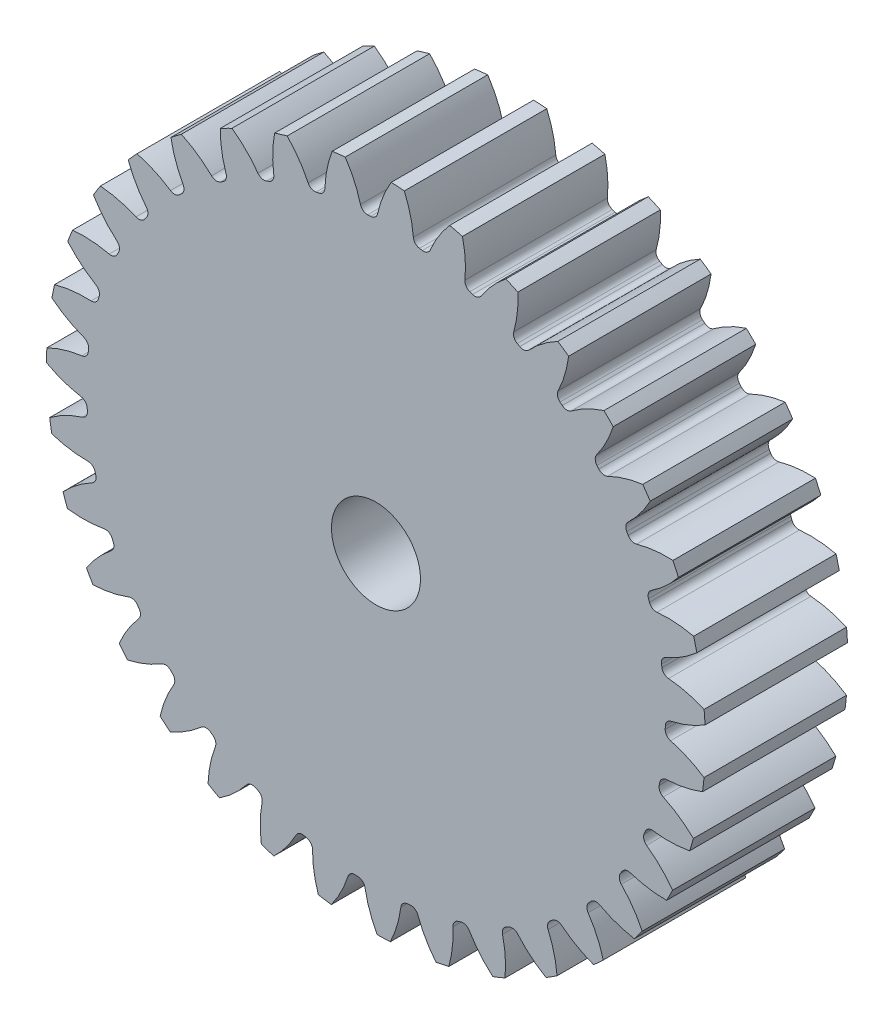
SolidWorks part; units mm, degrees
ref_plane "Front" through (0, 0, 0) normal (0, 0, 1) x (1, 0, 0)
ref_plane "Top" through (0, 0, 0) normal (0, 1, 0) x (1, 0, 0)
ref_plane "Right" through (0, 0, 0) normal (1, 0, 0) x (0, 0, -1)
sketch "Sketch3" plane through (0, 0, 0) normal (0, 0, 1) x (1, 0, 0)
  circle A0 centre (0, 0) radius 234.95
  dimension "od" = 469.9
extrude "gearBody" add sketch "Sketch3" along normal blind 101.6
sketch "Sketch2" plane through (0, 0, 0) normal (0, 0, 1) x (1, 0, 0)
  line L0 (0, 0) -> (192.9492, 79.9222) construction
  line L1 (234.2444, -21.5553) -> (0, 0) construction
  line L2 (0, 0) -> (36.3143, 0) construction
  line L3 (222.1891, 5.2033) -> (221.7657, -14.6639) construction
  line L5 (221.9774, -4.7303) -> (0, 0) construction
  line L7 (0, 0) -> (208.8467, 0) construction
  arc A0 (208.8428, 1.2757) -> (208.5989, -10.1712) centre (0, 0) ccw construction
  arc A1 (234.6738, 11.388) -> (233.9757, -21.3748) centre (0, 0) ccw construction
  arc A2 (222.1891, 5.2033) -> (221.7657, -14.6639) centre (0, 0) ccw construction
  arc A3 (206.3034, -5.437) -> (206.3477, -3.3565) centre (0, 0) ccw
  arc A4 (234.2444, -21.5553) -> (210.1329, -10.566) centre (189.3693, -88.0693) ccw
  arc A5 (234.2444, -21.5553) -> (234.95, 11.5569) centre (0, 0) ccw
  arc A6 (234.95, 11.5569) -> (210.3922, 1.6047) centre (192.9492, 79.9222) cw
  arc A7 (206.3477, -3.3565) -> (210.3922, 1.6047) centre (211.5159, -3.4405) cw
  arc A8 (210.1329, -10.566) -> (206.3034, -5.437) centre (211.4705, -5.5732) cw
  point P6 (234.95, 11.5569)
  point P22 (234.2444, -21.5553)
  dimension "baseDia" = 417.6934
  dimension "od" = 469.9
  dimension "pd" = 444.5
  dimension "rd" = 412.75
  dimension "rFillet" = 5.1689
  dimension "pointX" = 234.95
  dimension "pointY" = 11.5569
  dimension "CTT" = 19.8672
  dimension "flankCenterAngle" = 22.5
extrude "toothCut" cut sketch "Sketch2" along normal through all
pattern_circular "CirPattern1" count 35 over 360 about axis through (0, 0, 0) along (0, 0, 1) of "toothCut"
sketch "hub1Dia" plane through (0, 0, 0) normal (0, 0, -1) x (-1, 0, 0)
  circle A0 centre (0, 0) radius 12.7
  dimension "hub1Dia" = 25.4
sketch "hub2Dia" plane through (0, 0, 101.6) normal (0, 0, 1) x (1, 0, 0)
  circle A0 centre (0, 0) radius 12.7
  dimension "hub2dia" = 25.4
sketch "boreDia" plane through (0, 0, 0) normal (0, 0, 1) x (1, 0, 0)
  circle A0 centre (0, 0) radius 31.75
  dimension "boreDia" = 63.5
extrude "bore" cut sketch "boreDia" against normal mid plane 25400
